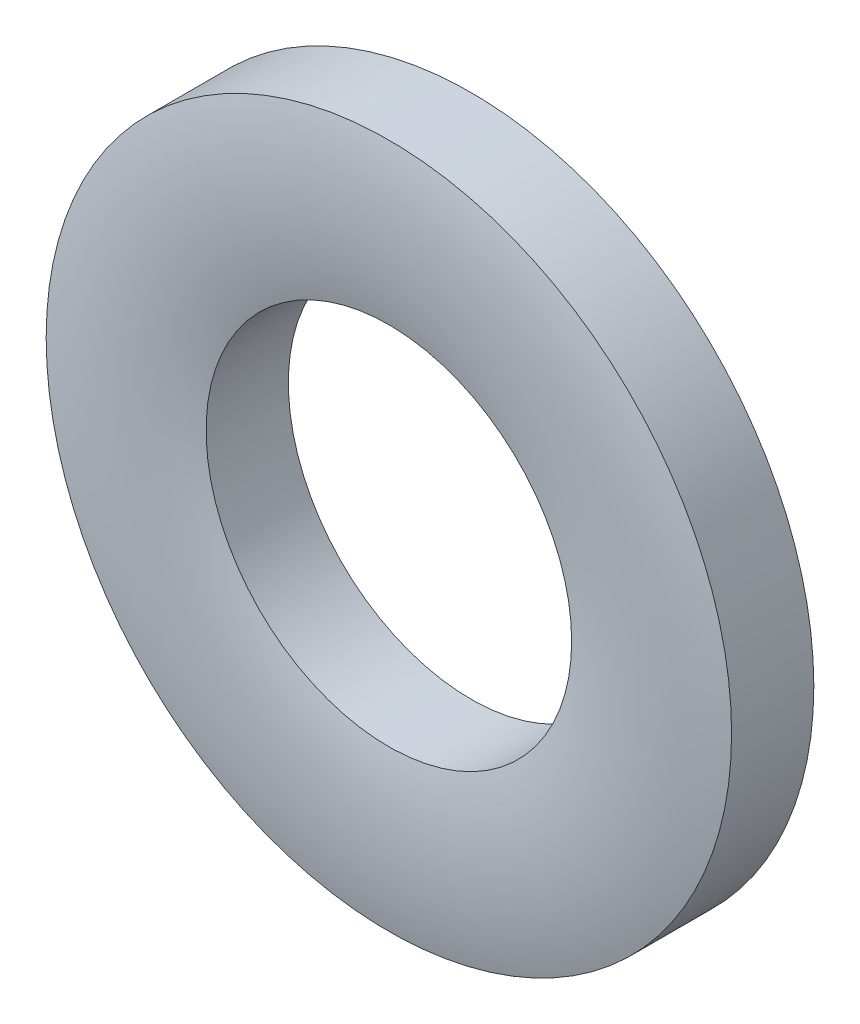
SolidWorks part; units mm, degrees
ref_plane "Front Plane" through (0, 0, 0) normal (0, 0, 1) x (1, 0, 0)
ref_plane "Top Plane" through (0, 0, 0) normal (0, 1, 0) x (1, 0, 0)
ref_plane "Right Plane" through (0, 0, 0) normal (1, 0, 0) x (0, 0, -1)
sketch "Sketch1" plane through (0, 0, 0) normal (0, 0, 1) x (1, 0, 0)
  circle A0 centre (0, 0) radius 3.2
  circle A1 centre (0, 0) radius 6
  dimension "ID" = 6.4
  dimension "OD" = 12
sketch "Sketch2" plane through (0, 0, 0) normal (1, 0, 0) x (0, 0, -1)
  line L0 (-0.8, 6) -> (0.8, 6) construction
  line L1 (-0.8, 0) -> (0.8, 0) construction
  point P2 (0, 6)
sketch "Sketch3" plane through (0, 0, 0) normal (1, 0, 0) x (0, 0, -1)
  line L0 (0.8, 6) -> (-0.64, 6)
  line L1 (0.8, 3.2) -> (-0.64, 3.2)
  line L2 (0.8, 3.2) -> (0.8, 6)
  line L3 (-0.8, 6) -> (-0.8, 3.2) construction
  arc A0 (-0.64, 3.2) -> (-0.64, 6) centre (5.405, 4.6) cw
  point P9 (0, 3.2)
revolve "Revolve1" add sketch "Sketch3" angle 360 about L1
equation "\"D1@Sketch3\"=\"Thickness Range@Sketch2\"*.1"
